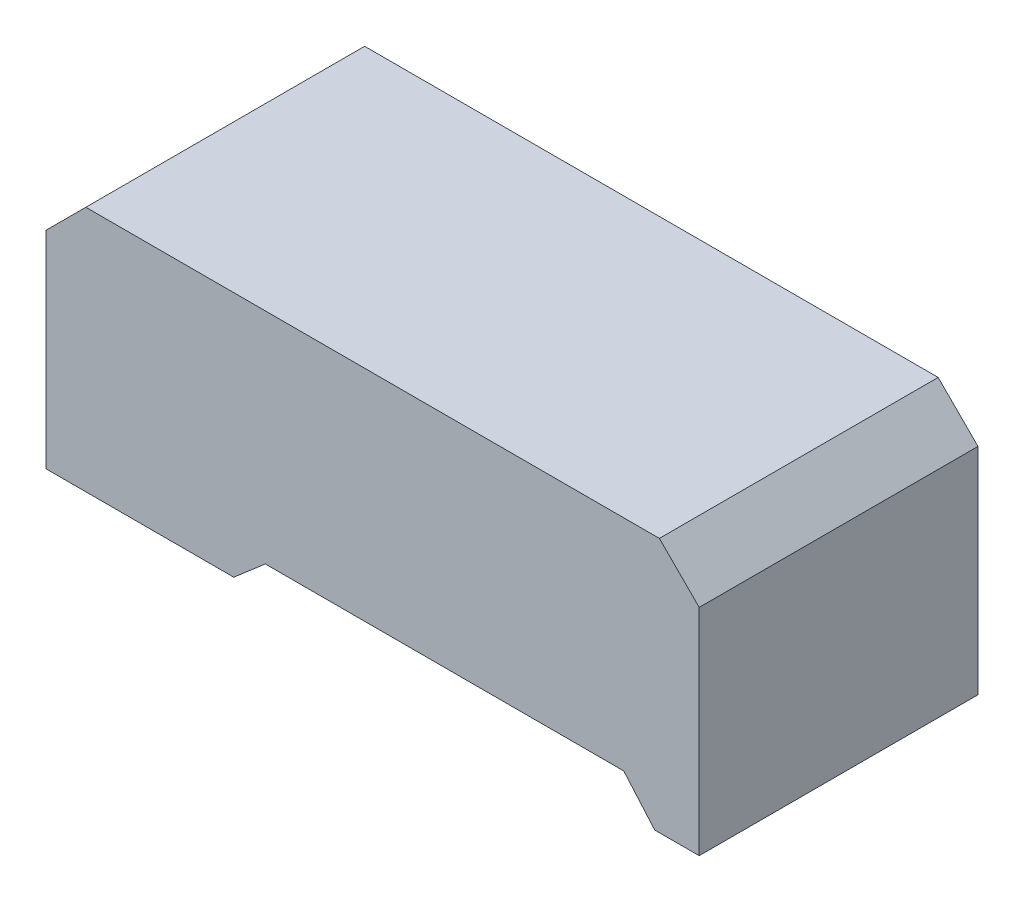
SolidWorks part; units mm, degrees
ref_plane "Plan de face" through (0, 0, 0) normal (0, 0, 1) x (1, 0, 0)
ref_plane "Plan de dessus" through (0, 0, 0) normal (0, 1, 0) x (1, 0, 0)
ref_plane "Plan de droite" through (0, 0, 0) normal (1, 0, 0) x (0, 0, -1)
sketch "Esquisse1" plane through (0, 0, 0) normal (0, 0, 1) x (1, 0, 0)
  line L0 (-86.7445, -19.1376) -> (-63.1751, -19.1376)
  line L1 (-63.1751, -19.1376) -> (-59.2156, -15.7188)
  line L2 (-59.2156, -15.7188) -> (-14.2156, -15.7188)
  line L3 (-14.2156, -15.7188) -> (-10.3332, -20.2015)
  line L4 (-10.3332, -20.2015) -> (-4.7445, -20.2015)
  line L5 (-4.7445, -20.2015) -> (-4.7445, 11.7985)
  line L6 (-4.7445, 11.7985) -> (-86.7445, 11.7985)
  line L7 (-86.7445, 11.7985) -> (-86.7445, -19.1376)
  dimension "D1" = 45
  dimension "D2" = 82
  dimension "D3" = 32
extrude "Extrusion1" add sketch "Esquisse1" along normal blind 35
chamfer "Chanfrein1" distance 5 angle 45 2 edges at (-86.7445, 11.7985, 17.5) (-4.7445, 11.7985, 17.5)
